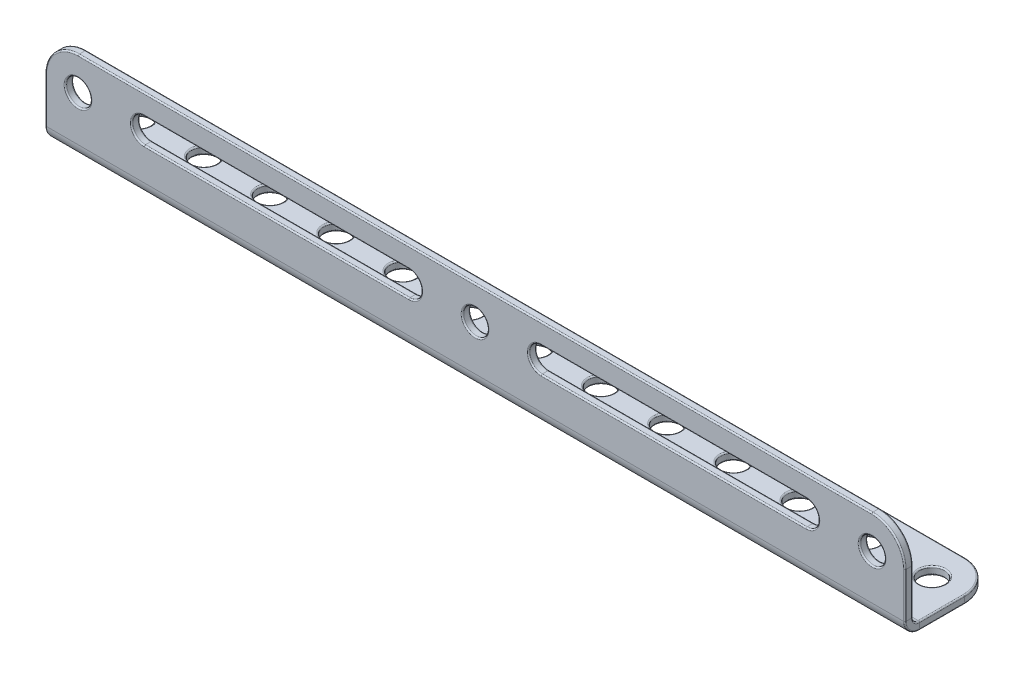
SolidWorks part; units mm, degrees
ref_plane "Front" through (0, 0, 0) normal (0, 0, 1) x (1, 0, 0)
ref_plane "Top" through (0, 0, 0) normal (0, 1, 0) x (1, 0, 0)
ref_plane "Right" through (0, 0, 0) normal (1, 0, 0) x (0, 0, -1)
sketch "Sketch1" plane through (0, 0, 0) normal (0, 1, 0) x (1, 0, 0)
  line L1 (6.35, 0) -> (158.623, 0)
  line L2 (0, 6.35) -> (0, 29.21)
  line L3 (6.35, 35.56) -> (158.623, 35.56)
  line L4 (164.973, 6.35) -> (164.973, 29.21)
  line L5 (18.9865, 8.763) -> (69.7865, 8.763)
  line L6 (95.1865, 8.763) -> (145.9865, 8.763)
  line L7 (18.9865, 3.937) -> (69.7865, 3.937)
  line L9 (95.1865, 3.937) -> (145.9865, 3.937)
  circle A0 centre (6.2865, 6.35) radius 2.413
  circle A1 centre (82.4865, 6.35) radius 2.413
  circle A2 centre (158.6865, 6.35) radius 2.413
  arc A3 (6.35, 0) -> (0, 6.35) centre (6.35, 6.35) cw
  arc A4 (0, 29.21) -> (6.35, 35.56) centre (6.35, 29.21) cw
  arc A5 (158.623, 35.56) -> (164.973, 29.21) centre (158.623, 29.21) cw
  arc A6 (158.623, 0) -> (164.973, 6.35) centre (158.623, 6.35) ccw
  arc A7 (18.9865, 8.763) -> (18.9865, 3.937) centre (18.9865, 6.35) ccw
  arc A8 (69.7865, 3.937) -> (69.7865, 8.763) centre (69.7865, 6.35) ccw
  arc A9 (95.1865, 8.763) -> (95.1865, 3.937) centre (95.1865, 6.35) ccw
  arc A10 (145.9865, 3.937) -> (145.9865, 8.763) centre (145.9865, 6.35) ccw
  point P20 (0, 0)
  point P23 (0, 35.56)
  point P26 (164.973, 35.56)
  dimension "D3" = 4.826
  dimension "D5" = 6.35
  dimension "D4" = 6.35
  dimension "D9" = 12.7
  dimension "D6" = 4.826
  dimension "D1" = 35.56
  dimension "D2" = 164.973
  dimension "D7" = 82.4865
  dimension "D8" = 12.7
  dimension "D10" = 12.7
  dimension "D11" = 12.7
  dimension "D12" = 50.8
sheet metal parameters "Sheet-Metal1" thickness 1.524 parameters "D1"=3.81
base flange "Base-Flange1" sketch "Sketch1" thickness 1.524 reverse thickness direction yes parameters "D1"=3.81
sketch "Sketch3" plane through (0, 1.524, 0) normal (0, 1, 0) x (-1, 0, 0)
  line L5 (0, -29.21) -> (0, -6.35) construction
  line L6 (0, -17.78) -> (-164.973, -17.78)
  line L10 (-164.973, -6.35) -> (-164.973, -29.21) construction
  line L11 (-6.35, 0) -> (-158.623, 0) construction
  dimension "D1" = 17.78
sketched bend "Sketched Bend1" parameters "D1"=1.27
bend "SketchBend2" bend radius 1.27 bend angle 90 parameters "D5"=1
sketch "Sketch4" plane through (0, 1.524, 0) normal (0, 1, 0) x (-1, 0, 0)
  circle A0 centre (-6.35, -29.21) radius 2.413
  arc A3 (-6.35, -35.56) -> (0, -29.21) centre (-6.35, -29.21) ccw construction
  dimension "D1" = 4.826
extrude "Cut-Extrude1" cut sketch "Sketch4" against normal through all
pattern_linear "LPattern1" count 13 spacing 12.7 along (1, 0, 0) of "Cut-Extrude1"
fillet "Fillet1" radius 0.254 72 edges at (163.1131, 15.9201, -19.304) (6.35, 0, -26.797) (6.35, 1.524, -26.797) (19.05, 0, -26.797) (19.05, 1.524, -26.797) (31.75, 0, -26.797) (31.75, 1.524, -26.797) (44.45, 0, -26.797) (44.45, 1.524, -26.797) (164.973, 7.112, -19.304) (57.15, 0, -26.797) (57.15, 1.524, -26.797) (69.85, 0, -26.797) (69.85, 1.524, -26.797) (82.55, 0, -26.797) (82.55, 1.524, -26.797) (95.25, 0, -26.797) (95.25, 1.524, -26.797) (107.95, 0, -26.797) (107.95, 1.524, -26.797) (120.65, 0, -26.797) (120.65, 1.524, -26.797) (133.35, 0, -26.797) (133.35, 1.524, -26.797) (146.05, 0, -26.797) (146.05, 1.524, -26.797) (158.75, 0, -26.797) (158.75, 1.524, -26.797) (16.5735, 11.43, -17.78) (44.3865, 13.843, -17.78) (72.1995, 11.43, -17.78) (44.3865, 9.017, -17.78) (16.5735, 11.43, -19.304) (44.3865, 13.843, -19.304) (72.1995, 11.43, -19.304) (44.3865, 9.017, -19.304) (92.7735, 11.43, -17.78) (120.5865, 13.843, -17.78) (148.3995, 11.43, -17.78) (120.5865, 9.017, -17.78) (92.7735, 11.43, -19.304) (120.5865, 13.843, -19.304) (148.3995, 11.43, -19.304) (120.5865, 9.017, -19.304) (1.8599, 15.9201, -19.304) (6.2865, 13.843, -17.78) (6.2865, 13.843, -19.304) (82.4865, 13.843, -17.78) (82.4865, 13.843, -19.304) (158.6865, 13.843, -17.78) (158.6865, 13.843, -19.304) (82.4865, 17.78, -19.304) (0, 7.112, -17.78) (0, 7.112, -19.304) (164.973, 7.112, -17.78) (163.1131, 15.9201, -17.78) (1.8599, 0, -33.7001) (82.4865, 0, -35.56) (163.1131, 0, -33.7001) (0, 1.524, -24.892) (164.973, 1.524, -24.892) (163.1131, 1.524, -33.7001) (82.4865, 1.524, -35.56) (1.8599, 1.524, -33.7001) (164.973, 0, -24.892) (0, 0, -24.892) (0, 0.8183, -18.5983) (164.973, 0.8183, -18.5983) (164.973, 1.896, -19.676) (0, 1.896, -19.676) (82.4865, 17.78, -17.78) (1.8599, 15.9201, -17.78)
flat pattern "Flat-Pattern1"
sketch "Bend-Lines1" plane through (0, 0, 0) normal (0, 1, 0) x (-1, 0, 0)
bend of the flat pattern "Flatten-<SketchBend2>1"
